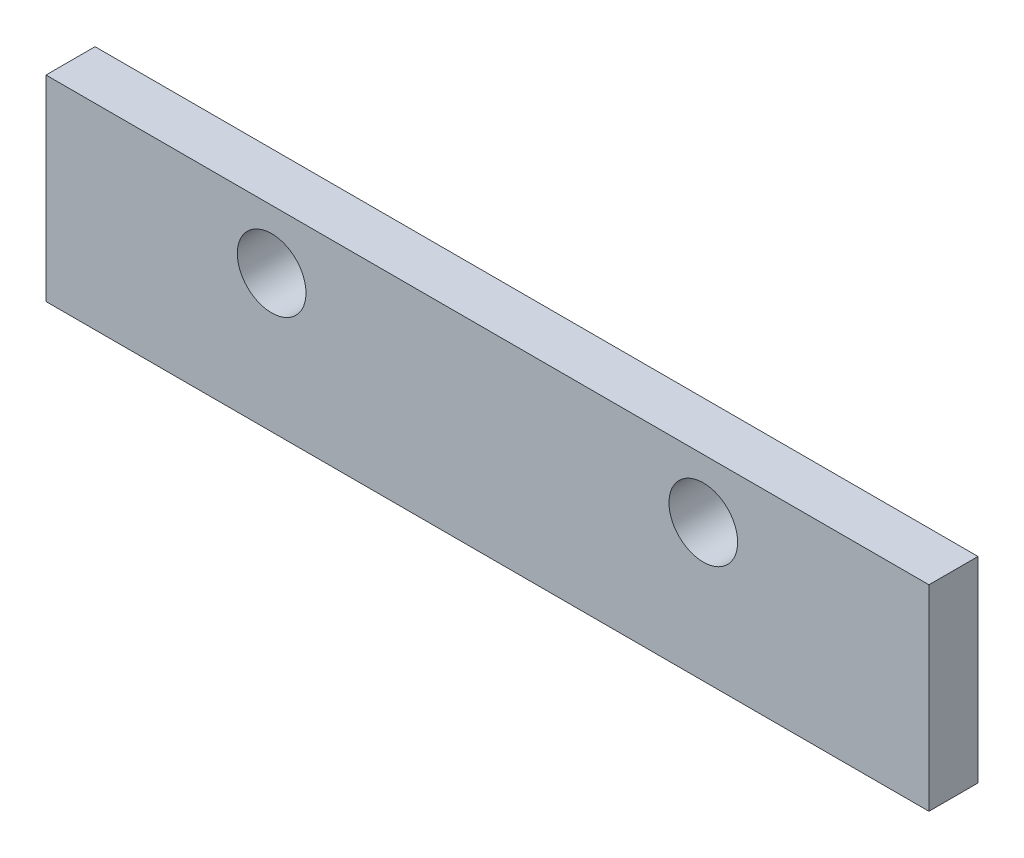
SolidWorks part; units mm, degrees
ref_plane "Face" through (0, 0, 0) normal (0, 0, 1) x (1, 0, 0)
ref_plane "Dessus" through (0, 0, 0) normal (0, 1, 0) x (1, 0, 0)
ref_plane "Droite" through (0, 0, 0) normal (1, 0, 0) x (0, 0, -1)
sketch "Esquisse1" plane through (0, 0, 0) normal (0, 0, 1) x (1, 0, 0)
  line L0 (-110.6157, 4) -> (108.7085, 4) construction
  line L1 (-45, 10) -> (45, 10)
  line L2 (-45, 10) -> (-45, -10)
  line L3 (-45, -10) -> (45, -10)
  line L4 (45, 10) -> (45, -10)
  circle A0 centre (-22, 4) radius 3.5
  circle A1 centre (22, 4) radius 3.5
  dimension "D5" = 7
  dimension "D6" = 44
  dimension "D8" = 22
  dimension "D1" = 90
  dimension "D2" = 20
  dimension "D3" = 10
  dimension "D4" = 45
  dimension "D7" = 14
extrude "Extrusion1" add sketch "Esquisse1" along normal blind 5
